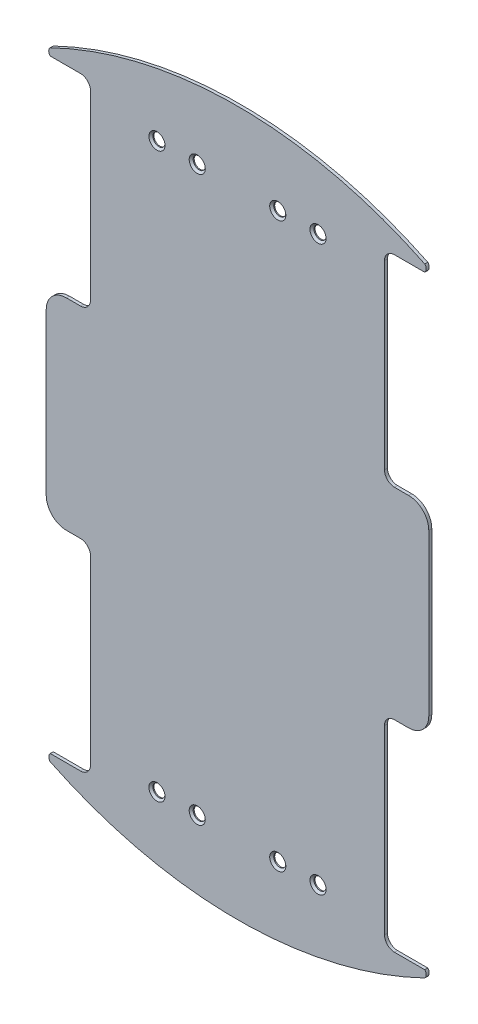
SolidWorks part; units mm, degrees
ref_plane "Alzado" through (0, 0, 0) normal (0, 0, 1) x (1, 0, 0)
ref_plane "Planta" through (0, 0, 0) normal (0, 1, 0) x (1, 0, 0)
ref_plane "Vista lateral" through (0, 0, 0) normal (1, 0, 0) x (0, 0, -1)
ref_plane "Plano1" through (0, 0, 1.5) normal (0, 0, 1) x (1, 0, 0)
sketch "Croquis1" plane through (0, 0, 1.5) normal (0, 0, 1) x (1, 0, 0)
  line L0 (20, 300) -> (20, 0)
  line L1 (20, 0) -> (0, 0)
  line L2 (186, 0) -> (166, 0)
  line L3 (166, 0) -> (166, 300)
  line L4 (166, 300) -> (186, 300)
  line L5 (0, 300) -> (20, 300)
  arc A0 (0, 0) -> (0, -3.5687) centre (1.7844, -1.7844) ccw
  arc A1 (0, -3.5687) -> (186, -3.5687) centre (93, 187.5) ccw
  arc A2 (186, -3.5687) -> (186, 0) centre (184.2156, -1.7844) ccw
  arc A3 (186, 300) -> (186, 303.5716) centre (184.2142, 301.7858) ccw
  arc A4 (186, 303.5716) -> (-0.0323, 303.5501) centre (93.006, 112.5) ccw
  arc A5 (-0.0323, 303.5501) -> (0, 300) centre (1.7588, 301.7912) ccw
extrude "Saliente-Extruir1" add sketch "Croquis1" against normal blind 1.5
sketch "Croquis2" plane through (20, 0, 0) normal (-1, 0, 0) x (0, 0, 1)
  line L0 (0, 100) -> (0, 200)
  line L1 (0, 200) -> (1.5, 200)
  line L2 (1.5, 200) -> (1.5, 100)
  line L3 (1.5, 100) -> (0, 100)
extrude "Saliente-Extruir2" add sketch "Croquis2" along normal blind 22
sketch "Croquis3" plane through (166, 0, 0) normal (1, 0, 0) x (0, 0, -1)
  line L0 (0, 200) -> (0, 100)
  line L1 (0, 100) -> (-1.5, 100)
  line L2 (-1.5, 100) -> (-1.5, 200)
  line L3 (-1.5, 200) -> (0, 200)
extrude "Saliente-Extruir3" add sketch "Croquis3" along normal blind 22
hole_wizard "Diámetro de taladro Ø6.0 (6)1" positions "Croquis5" profile "Croquis4" hole size "Ø6.0" standard "Ansi Metric"
sketch "Croquis5" plane through (0, 0, 1.5) normal (0, 0, 1) x (1, 0, 0)
  line L1 (166, 200) -> (166, 300) construction
  point P0 (133, 290)
  point P1 (53, 10)
  point P2 (133, 10)
  point P3 (53, 290)
  dimension "D1" = 80
  dimension "D2" = 33
  dimension "D3" = 280
sketch "Croquis4" plane through (133, 290, 1.5) normal (1, 0, 0) x (0, -1, 0)
  line L0 (0, 0) -> (0, 1.5)
  line L1 (0, 1.5) -> (3, 1.5)
  line L2 (3, 1.5) -> (3, 1)
  line L3 (3, 1) -> (4, 0)
  line L5 (4, 0) -> (0, 0)
  line L6 (-3, 1) -> (-4, 0) construction
  line L11 (0, -6.35) -> (0, 107.95) construction
  dimension "Diámetro de taladro hasta el siguiente" = 6
  dimension "Profundidad de taladro hasta el siguiente" = 1.5
  dimension "Diámetro de avellanado cercano" = 8
  dimension "Ángulo de avellanado cercano" = 90
fillet "Redondeo1" radius 5 8 edges at (166, 200, 0.75) (166, 300, 0.75) (20, 100, 0.75) (166, 0, 0.75) (166, 100, 0.75) (20, 200, 0.75) (20, 0, 0.75) (20, 300, 0.75)
fillet "Redondeo2" radius 10 4 edges at (188, 100, 0.75) (188, 200, 0.75) (-2, 100, 0.75) (-2, 200, 0.75)
pattern_linear "MatrizL1" count 2 spacing 20 along (1, 0, 0) of "Diámetro de taladro Ø6.0 (6)1"
pattern_linear "MatrizL2" count 2 spacing 20 along (-1, 0, 0) of "Diámetro de taladro Ø6.0 (6)1"
